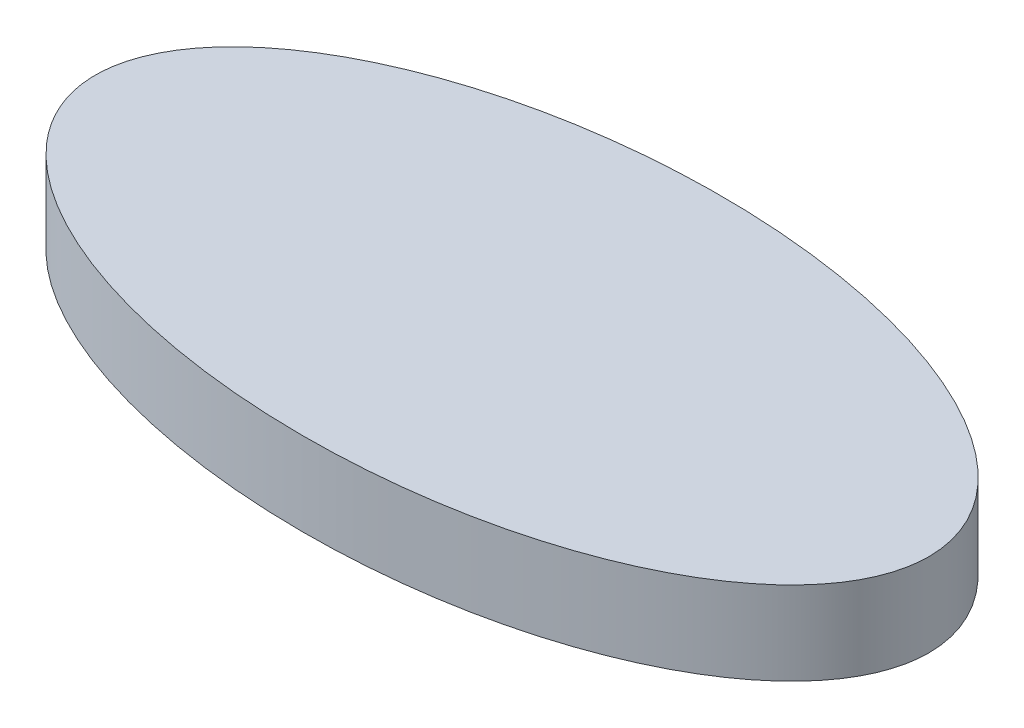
SolidWorks part; units mm, degrees
ref_plane "Front Plane" through (0, 0, 0) normal (0, 0, 1) x (1, 0, 0)
ref_plane "Top Plane" through (0, 0, 0) normal (0, 1, 0) x (1, 0, 0)
ref_plane "Right Plane" through (0, 0, 0) normal (1, 0, 0) x (0, 0, -1)
sketch "Sketch1" plane through (0, 0, 0) normal (0, 1, 0) x (1, 0, 0)
  ellipse E0 centre (0, 0) end of major axis (10, 0) minor radius 5
  dimension "D1" = 20
  dimension "D2" = 10
extrude "Boss-Extrude1" add sketch "Sketch1" along normal blind 2
